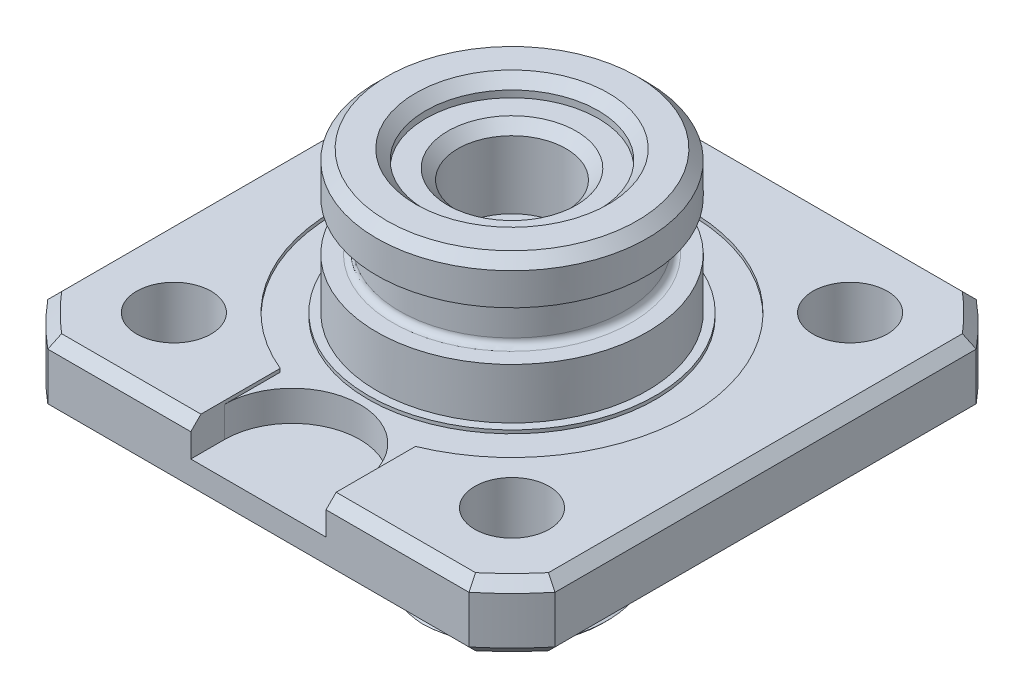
SolidWorks part; units mm, degrees
ref_plane "前视基准面" through (0, 0, 0) normal (0, 0, 1) x (1, 0, 0)
ref_plane "上视基准面" through (0, 0, 0) normal (0, 1, 0) x (1, 0, 0)
ref_plane "右视基准面" through (0, 0, 0) normal (1, 0, 0) x (0, 0, -1)
sketch "草图1" plane through (0, 0, 0) normal (1, 0, 0) x (0, 0, -1)
  line L0 (0, 0) -> (0, 4.5353) construction
  line L1 (-0.75, 0) -> (-1.6, 0)
  line L2 (-1.6, 0) -> (-1.6, -4)
  line L3 (-1.6, -4) -> (-2.1, -5)
  line L4 (-2.1, -5) -> (-3, -5)
  line L5 (-3, -5) -> (-3, -1.7)
  line L6 (-3, -1.7) -> (-2.5, -1.7)
  line L7 (-2.5, -1.7) -> (-2.5, -0.7)
  line L8 (-2.5, -0.7) -> (-5.4, -0.7)
  line L9 (-5.4, -0.7) -> (-5.4, 1)
  line L16 (-4, 1) -> (-1.25, 1)
  line L17 (-1.25, 1) -> (-0.75, 0.5)
  line L18 (-0.75, 0.5) -> (-0.75, 0)
  line L24 (-4, 1) -> (-5.4, 1)
  dimension "D1" = 0.75
  dimension "D2" = 0.5
  dimension "D3" = 1
  dimension "D4" = 45
  dimension "D5" = 1.6
  dimension "D6" = 3
  dimension "D7" = 5
  dimension "D8" = 1
  dimension "D9" = 0.5
  dimension "D10" = 0.7
  dimension "D11" = 3.3
  dimension "D12" = 0.5
  dimension "D13" = 5.4
revolve "旋转1" add sketch "草图1" angle 360 about L0
sketch "草图7" plane through (0, -0.7, 0) normal (0, 1, 0) x (1, 0, 0)
  line L0 (-7.5, 5.5) -> (-7.5, -5.5)
  line L1 (-5.5, -7.5) -> (5.5, -7.5)
  line L2 (7.5, -5.5) -> (7.5, 5.5)
  line L3 (5.5, 7.5) -> (-5.5, 7.5)
  line L4 (0, 0) -> (0, -4.1519) construction
  line L5 (0, 0) -> (-4.2498, 0) construction
  arc A0 (-7.5, -5.5) -> (-5.5, -7.5) centre (-5.5, -5.5) ccw
  arc A1 (5.5, -7.5) -> (7.5, -5.5) centre (5.5, -5.5) ccw
  arc A4 (7.5, 5.5) -> (5.5, 7.5) centre (5.5, 5.5) ccw
  arc A5 (-5.5, 7.5) -> (-7.5, 5.5) centre (-5.5, 5.5) ccw
  point P0 (0, 0)
  dimension "D1" = 2
  dimension "D2" = 15
  dimension "D4" = 15
extrude "凸台-拉伸1" add sketch "草图7" along normal blind 2
hole_wizard "M2 间隙槽口8" positions "草图8" profile "草图9" size "M2" standard "GB"
sketch "草图8" plane through (0, -0.7, 0) normal (0, -1, 0) x (-1, 0, 0)
  line L4 (0, 0) -> (0, 4.7467) construction
  line L6 (0, 0) -> (-5.268, 0) construction
  point P0 (-5, -5)
  point P2 (5, -5)
  point P6 (-5, 5)
  point P45 (5, 5)
  dimension "D1" = 10
  dimension "D2" = 10
sketch "草图9" plane through (5, -0.7, 5) normal (1, 0, 0) x (0, 0, -1)
  line L0 (0, 0) -> (0, 2)
  line L1 (0, 2) -> (1.1, 2)
  line L2 (1.1, 2) -> (1.1, 0)
  line L5 (1.1, 0) -> (0, 0)
  line L11 (0, -6.35) -> (0, 107.95) construction
  dimension "通孔孔直径" = 2.2
  dimension "通孔孔深度" = 2
chamfer "倒角1" distance 0.3 angle 45
thread "螺纹线2" pitch 0.7 start angle 0, offset 1, length 3.6, pitch 0.7, diameter 6
ref_plane "基准面2" through (3, -5.7, 0) normal (0, 0, 1) x (1, 0, 0)
sketch "螺纹线轮廓2" plane through (3, -5.7, 0) normal (0, 0, 1) x (1, 0, 0)
  line L0 (0, 0) -> (0, 0.7) construction
  line L11 (0, 0) -> (0, 0.6125)
  line L12 (0, 0.6125) -> (-0.3789, 0.3937)
  line L13 (-0.3789, 0.3937) -> (-0.3789, 0.2187)
  line L15 (-0.3789, 0.2187) -> (0, 0)
  line L17 (-0.3789, 0.3062) -> (0, 0.3062) construction
  point P2 (0, 0)
  dimension "Pitch" = 0.7
  dimension "Profile_Angle" = 60
  dimension "Profile_Land" = 0.175
  dimension "Profile_Height" = 0.3789
sketch "草图10" plane through (0, 1.3, 0) normal (0, 1, 0) x (1, 0, 0)
  circle A0 centre (0, 0) radius 4
  dimension "D1" = 8
extrude "凸台-拉伸2" add sketch "草图10" along normal blind 2.5
sketch "草图11" plane through (0, -0.7, 0) normal (0, -1, 0) x (1, 0, 0)
  circle A1 centre (0, 0) radius 1.6
  circle A2 centre (0, 0) radius 1.6
  dimension "D1" = 0
extrude "切除-拉伸1" cut sketch "草图11" against normal blind 3.4
sketch "草图12" plane through (0, 2.7, 0) normal (0, -1, 0) x (1, 0, 0)
  circle A0 centre (0, 0) radius 1.6
  dimension "D1" = 3.2
extrude "切除-拉伸2" cut sketch "草图12" against normal through all
sketch "草图16" [suppressed] plane through (0, 3.8, 0) normal (0, 1, 0) x (1, 0, 0)
  circle A0 centre (0, 0) radius 2
  dimension "D1" = 4
chamfer "倒角5" [suppressed] distance 0.3 angle 45
sketch "草图17" plane through (0, -0.7, 0) normal (0, -1, 0) x (1, 0, 0)
  circle A0 centre (0, 0) radius 4
  circle A2 centre (0, 0) radius 3
  dimension "D1" = 8
  dimension "D2" = 6
extrude "切除-拉伸3" [suppressed] cut sketch "草图17" against normal blind 0.5
sketch "草图18" plane through (0, -0.7, 0) normal (0, -1, 0) x (1, 0, 0)
  line L4 (-5.5, -7.5) -> (5.5, -7.5)
  line L5 (-5.5, -7.5) -> (5.5, -7.5)
  line L6 (7.5, -5.5) -> (7.5, 5.5)
  line L7 (7.5, -5.5) -> (7.5, 5.5)
  line L8 (5.5, 7.5) -> (-5.5, 7.5)
  line L9 (5.5, 7.5) -> (-5.5, 7.5)
  line L10 (-7.5, 5.5) -> (-7.5, -5.5)
  line L11 (-7.5, 5.5) -> (-7.5, -5.5)
  circle A0 centre (0, 0) radius 2.5 construction
  circle A1 centre (0, 0) radius 2.5
  arc A4 (-7.5, -5.5) -> (-5.5, -7.5) centre (-5.5, -5.5) ccw
  arc A5 (-7.5, -5.5) -> (-5.5, -7.5) centre (-5.5, -5.5) ccw
  arc A6 (5.5, -7.5) -> (7.5, -5.5) centre (5.5, -5.5) ccw
  arc A7 (5.5, -7.5) -> (7.5, -5.5) centre (5.5, -5.5) ccw
  arc A8 (7.5, 5.5) -> (5.5, 7.5) centre (5.5, 5.5) ccw
  arc A9 (7.5, 5.5) -> (5.5, 7.5) centre (5.5, 5.5) ccw
  arc A10 (-5.5, 7.5) -> (-7.5, 5.5) centre (-5.5, 5.5) ccw
  arc A11 (-5.5, 7.5) -> (-7.5, 5.5) centre (-5.5, 5.5) ccw
  dimension "D1" = 0
extrude "切除-拉伸4" cut sketch "草图18" against normal blind 0.3
chamfer "倒角3" [suppressed] distance 0.3 angle 45
sketch "草图21" plane through (0, 3.8, 0) normal (0, 1, 0) x (1, 0, 0)
  circle A0 centre (0, 0) radius 1.6 construction
  circle A1 centre (0, 0) radius 4
  circle A2 centre (0, 0) radius 4
  circle A3 centre (0, 0) radius 1.6
  dimension "D1" = 0
extrude "凸台-拉伸4" add sketch "草图21" along normal blind 5
sketch "草图22" plane through (0, 8.8, 0) normal (0, 1, 0) x (1, 0, 0)
  line L1 (2.5, -2) -> (-2.5, -2)
  line L2 (2.5, -2) -> (2.5, 2)
  line L3 (2.5, 2) -> (-2.5, 2)
  line L4 (-2.5, -2) -> (-2.5, 2)
  line L5 (2.5, -2) -> (-2.5, 2) construction
  line L6 (2.5, 2) -> (-2.5, -2) construction
  point P0 (0, 0)
  dimension "D1" = 5
  dimension "D2" = 4
extrude "切除-拉伸5" cut sketch "草图22" against normal blind 1.46
sketch "草图24" plane through (0, 8.8, 0) normal (0, 1, 0) x (1, 0, 0)
  circle A0 centre (-2.5, -2) radius 0.65
  circle A1 centre (-2.5, 2) radius 0.65
  circle A2 centre (2.5, 2) radius 0.65
  circle A3 centre (2.5, -2) radius 0.65
  dimension "D1" = 1.3
extrude "切除-拉伸7" cut sketch "草图24" against normal up to surface (1.46 mm away)
chamfer "倒角7" distance 0.3 angle 45
sketch "草图14" plane through (0, 0, 0) normal (1, 0, 0) x (0, 0, -1)
  line L0 (0, 0) -> (0, 8.8498) construction
  line L1 (4, 1.3) -> (4, 8.5) construction
  line L2 (4, 3.1) -> (3.325, 3.1)
  line L3 (4, 3.1) -> (4, 4.55)
  line L4 (4, 4.55) -> (3.325, 4.55)
  line L5 (3.325, 3.1) -> (3.325, 4.55)
  line L7 (5.5, 1.3) -> (-5.5, 1.3) construction
  dimension "D1" = 1.45
  dimension "D2" = 3.325
  dimension "D3" = 1.8
revolve "切除-旋转1" cut sketch "草图14" angle 360 about L0
sketch "草图25" plane through (0, 1.3, 0) normal (0, 1, 0) x (1, 0, 0)
  line L4 (-7.5, 5.5) -> (-7.5, -5.5)
  line L5 (-5.5, -7.5) -> (5.5, -7.5)
  line L6 (7.5, -5.5) -> (7.5, 5.5)
  line L7 (5.5, 7.5) -> (-5.5, 7.5)
  line L8 (-7.5, 5.5) -> (-7.5, -5.5)
  line L9 (-5.5, -7.5) -> (5.5, -7.5)
  line L10 (7.5, -5.5) -> (7.5, 5.5)
  line L11 (5.5, 7.5) -> (-5.5, 7.5)
  circle A0 centre (-5, 5) radius 1.1 construction
  circle A1 centre (5, 5) radius 1.1 construction
  circle A2 centre (-5, -5) radius 1.1 construction
  circle A3 centre (5, -5) radius 1.1 construction
  arc A4 (-5.5, 7.5) -> (-7.5, 5.5) centre (-5.5, 5.5) ccw
  arc A5 (-7.5, -5.5) -> (-5.5, -7.5) centre (-5.5, -5.5) ccw
  arc A6 (5.5, -7.5) -> (7.5, -5.5) centre (5.5, -5.5) ccw
  arc A7 (7.5, 5.5) -> (5.5, 7.5) centre (5.5, 5.5) ccw
  arc A8 (-5.5, 7.5) -> (-7.5, 5.5) centre (-5.5, 5.5) ccw
  arc A9 (-7.5, -5.5) -> (-5.5, -7.5) centre (-5.5, -5.5) ccw
  arc A10 (5.5, -7.5) -> (7.5, -5.5) centre (5.5, -5.5) ccw
  arc A11 (7.5, 5.5) -> (5.5, 7.5) centre (5.5, 5.5) ccw
  circle A12 centre (-5, 5) radius 1.1
  circle A13 centre (5, 5) radius 1.1
  circle A14 centre (-5, -5) radius 1.1
  circle A15 centre (5, -5) radius 1.1
  dimension "D1" = 0
extrude "凸台-拉伸5" add sketch "草图25" along normal blind 0.3
sketch "草图27" plane through (0, 1.6, 0) normal (0, 1, 0) x (1, 0, 0)
  line L0 (0, 0) -> (0, -8.353) construction
  line L1 (-5.5, -7.5) -> (5.5, -7.5) construction
  line L2 (2, -7.5) -> (-2, -7.5)
  line L3 (2, -7.5) -> (2, -4.8541)
  line L5 (-2, -7.5) -> (-2, -4.8541)
  circle A0 centre (0, 0) radius 4.25
  arc A1 (2, -4.8541) -> (-2, -4.8541) centre (0, 0) ccw
  dimension "D1" = 8.5
  dimension "D2" = 10.5
  dimension "D3" = 2
  dimension "D4" = 2
extrude "切除-拉伸8" cut sketch "草图27" against normal blind 0.1
sketch "草图28" plane through (0, 1.5, 0) normal (0, 1, 0) x (1, 0, 0)
  line L0 (-2, -4.8541) -> (-2, -7.5) construction
  line L1 (2, -7.5) -> (-2, -7.5)
  line L2 (2, -7.5) -> (2, -5.5)
  line L3 (2, -5.5) -> (-2, -5.5)
  line L4 (-2, -7.5) -> (-2, -5.5)
  dimension "D1" = 2
extrude "切除-拉伸9" cut sketch "草图28" against normal blind 0.9
fillet "圆角1" radius 1
fillet "圆角2" [suppressed] radius 1
chamfer "倒角6" [suppressed] distance 0.3 angle 45
chamfer "倒角8" [suppressed] distance 0.3 angle 45
sketch "草图29" plane through (0, 1.6, 0) normal (0, 1, 0) x (1, 0, 0)
  circle A0 centre (0, 0) radius 1
  dimension "D1" = 2
extrude "切除-拉伸10" cut sketch "草图29" against normal through all
sketch "草图30" plane through (0, 1.6, 0) normal (0, 1, 0) x (1, 0, 0)
  circle A0 centre (0, 0) radius 1 construction
  circle A1 centre (0, 0) radius 1.6
  circle A2 centre (0, 0) radius 1.6
  circle A3 centre (0, 0) radius 1
  dimension "D1" = 0
extrude "凸台-拉伸6" add sketch "草图30" along normal blind 1.4
sketch "草图31" plane through (0, 1.3, 0) normal (0, -1, 0) x (1, 0, 0)
  circle A0 centre (0, 0) radius 1 construction
  circle A1 centre (0, 0) radius 1.6
  circle A2 centre (0, 0) radius 1.6
  circle A3 centre (0, 0) radius 1
  dimension "D1" = 0
extrude "切除-拉伸11" cut sketch "草图31" against normal blind 1.4
fillet "圆角3" radius 0.2
chamfer "倒角9" distance 0.3 angle 45
chamfer "倒角10" distance 0.3 angle 45
chamfer "倒角11" distance 0.3 angle 45
sketch "草图32" plane through (0, 8.8, 0) normal (0, 1, 0) x (1, 0, 0)
  circle A0 centre (0, 0) radius 4.25
extrude "切除-拉伸12" cut sketch "草图32" against normal blind 3
sketch "草图33" plane through (0, 5.8, 0) normal (0, 1, 0) x (1, 0, 0)
  circle A0 centre (0, 0) radius 2.55
  dimension "D1" = 5.1
extrude "切除-拉伸13" cut sketch "草图33" against normal blind 0.5
chamfer "倒角12" distance 0.3 angle 45
sketch "草图34" plane through (0, -0.4, 0) normal (0, -1, 0) x (1, 0, 0)
  line L0 (-7.5, 5.5) -> (-7.5, 7.5)
  line L1 (7.5, -7.5) -> (5.5, -7.5)
  line L2 (7.5, -7.5) -> (7.5, -5.5)
  line L3 (7.5, 7.5) -> (5.5, 7.5)
  line L4 (-7.5, -7.5) -> (-7.5, -5.5)
  line L5 (7.5, -7.5) -> (-7.5, 7.5) construction
  line L6 (7.5, 7.5) -> (-7.5, -7.5) construction
  line L7 (-5.5, 7.5) -> (-7.5, 7.5)
  line L8 (7.5, 5.5) -> (7.5, 7.5)
  line L9 (-5.5, -7.5) -> (-7.5, -7.5)
  arc A0 (-7.5, -5.5) -> (-5.5, -7.5) centre (-5.5, -5.5) ccw construction
  arc A1 (5.5, -7.5) -> (7.5, -5.5) centre (5.5, -5.5) ccw construction
  arc A2 (7.5, 5.5) -> (5.5, 7.5) centre (5.5, 5.5) ccw construction
  arc A3 (-5.5, 7.5) -> (-7.5, 5.5) centre (-5.5, 5.5) ccw construction
  arc A4 (-7.5, -5.5) -> (-5.5, -7.5) centre (-5.5, -5.5) ccw
  arc A5 (5.5, -7.5) -> (7.5, -5.5) centre (5.5, -5.5) ccw
  arc A6 (7.5, 5.5) -> (5.5, 7.5) centre (5.5, 5.5) ccw
  arc A7 (-5.5, 7.5) -> (-7.5, 5.5) centre (-5.5, 5.5) ccw
  point P12 (0, 0)
extrude "凸台-拉伸7" add sketch "草图34" against normal up to surface (2 mm away)
sketch "草图35" plane through (0, -0.4, 0) normal (0, -1, 0) x (1, 0, 0)
  circle A0 centre (0, 0) radius 10.8163
  circle A1 centre (0, 0) radius 9.75
  dimension "D1" = 19.5
extrude "切除-拉伸14" cut sketch "草图35" against normal through all
chamfer "倒角13" distance 0.3 angle 45
chamfer "倒角14" distance 0.3 angle 45
sketch "草图36" plane through (0, 1.5, 0) normal (0, 1, 0) x (1, 0, 0)
  line L1 (0, -7.3478) -> (0, -6.5) construction
  line L2 (-2, -7.3478) -> (-2, -6.5)
  line L3 (2, -7.3478) -> (2, -6.5)
  arc A0 (-2, -7.3478) -> (2, -7.3478) centre (0, -7.3478) ccw
  arc A1 (2, -6.5) -> (-2, -6.5) centre (0, -6.5) ccw
  point P2 (0, -6.9239)
  dimension "D1" = 2
  dimension "D2" = 6.5
extrude "切除-拉伸15" cut sketch "草图36" against normal up to surface (0.9 mm away)
sketch "草图37" plane through (0, -0.4, 0) normal (0, -1, 0) x (1, 0, 0)
  circle A0 centre (0, 0) radius 9.75
sketch "草图38" plane through (7.5, 0, 0) normal (1, 0, 0) x (0, 0, -1)
  line L1 (-8.0581, -2.2063) -> (8.8828, -2.2063)
  line L2 (-8.0581, -2.2063) -> (-8.0581, 2.6977)
  line L3 (-8.0581, 2.6977) -> (8.8828, 2.6977)
  line L4 (8.8828, -2.2063) -> (8.8828, 2.6977)
extrude "切除-拉伸16" [suppressed] cut sketch "草图38" against normal blind 0.25
